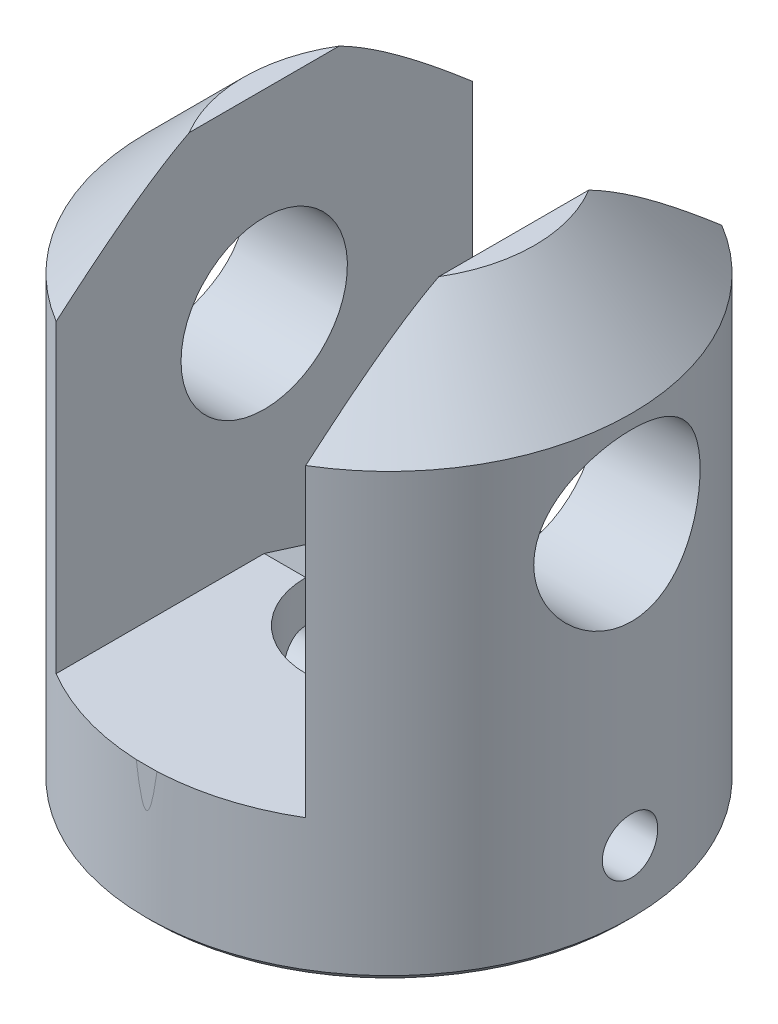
SolidWorks part; units mm, degrees
ref_plane "Plan de face" through (0, 0, 0) normal (0, 0, 1) x (1, 0, 0)
ref_plane "Plan de dessus" through (0, 0, 0) normal (0, 1, 0) x (1, 0, 0)
ref_plane "Plan de droite" through (0, 0, 0) normal (1, 0, 0) x (0, 0, -1)
sketch "Esquisse1" plane through (0, 0, 0) normal (0, 1, 0) x (1, 0, 0)
  circle A0 centre (0, 0) radius 17.5
  dimension "D1" = 35
extrude "Extrusion1" add sketch "Esquisse1" along normal blind 39
chamfer "Chanfrein1" distance 7 angle 45 1 edges at (0, 39, 17.5)
sketch "Esquisse6" plane through (0, 0, 0) normal (1, 0, 0) x (0, 0, -1)
  line L0 (-17.5, 0) -> (17.5, 0) construction
  circle A0 centre (0, 5) radius 2
  dimension "D1" = 4
  dimension "D2" = 5
extrude "Enlèv. mat.-Extru.4" cut sketch "Esquisse6" against normal through all and the other way through all
sketch "Esquisse3" plane through (0, 0, 0) normal (1, 0, 0) x (0, 0, -1)
  line L0 (-17.484, 10) -> (0, 10)
  line L1 (-17.5, 32) -> (-17.5, 0) construction
  line L2 (0, 10) -> (17.5, 4.5)
  line L3 (17.5, 0) -> (17.5, 32) construction
  line L4 (17.5, 4.5) -> (17.5, 32)
  line L5 (17.5, 32) -> (10.5, 39)
  line L6 (10.5, 39) -> (-10.5, 39)
  line L7 (-10.5, 39) -> (-17.5, 32) construction
  line L8 (10.5, 39) -> (-10.5, 39) construction
  line L9 (-10.5, 39) -> (-17.5, 32)
  line L10 (-17.5, 32) -> (-17.5, 7.2052)
  line L11 (-17.5, 7.2052) -> (-17.484, 10)
  line L13 (-17.5, 0) -> (17.5, 0) construction
  dimension "D1" = 10
  dimension "D2" = 4.5
extrude "Enlèv. mat.-Extru.1" cut sketch "Esquisse3" against normal mid plane 18
sketch "Esquisse4" plane through (0, 0, 0) normal (1, 0, 0) x (0, 0, -1)
  circle A0 centre (0, 25) radius 6
  circle A1 centre (0, 5) radius 2 construction
  dimension "D1" = 12
  dimension "D2" = 20
extrude "Enlèv. mat.-Extru.2" cut sketch "Esquisse4" against normal through all and the other way through all
sketch "Esquisse5" plane through (0, 0, 0) normal (0, -1, 0) x (1, 0, 0)
  circle A0 centre (0, 0) radius 6
  dimension "D1" = 12
extrude "Enlèv. mat.-Extru.3" cut sketch "Esquisse5" against normal through all
chamfer "Chanfrein2" distance 0.5 angle 45 1 edges at (0, 0, 17.5)
